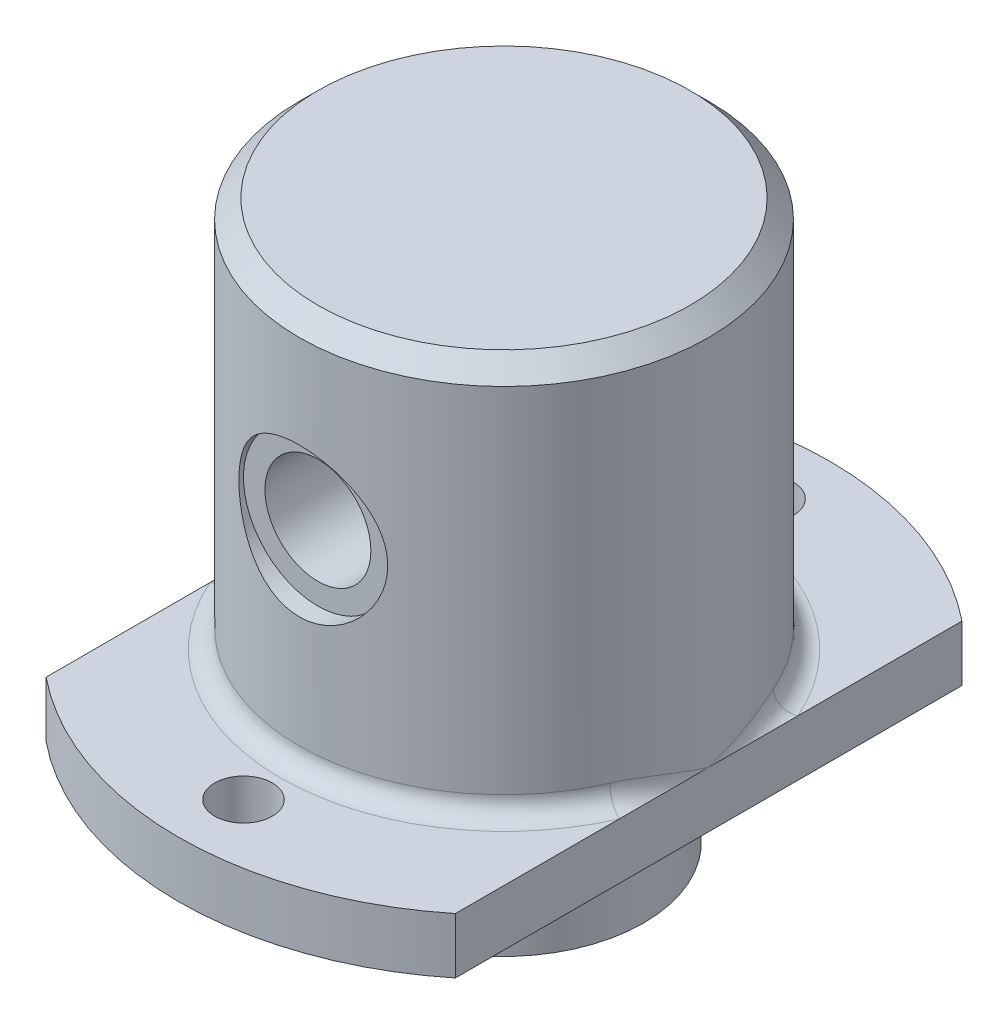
SolidWorks part; units mm, degrees
ref_plane "Front Plane" through (0, 0, 0) normal (0, 0, 1) x (1, 0, 0)
ref_plane "Top Plane" through (0, 0, 0) normal (0, 1, 0) x (1, 0, 0)
ref_plane "Right Plane" through (0, 0, 0) normal (1, 0, 0) x (0, 0, -1)
sketch "Sketch1" plane through (0, 0, 0) normal (0, 0, 1) x (1, 0, 0)
  line L0 (0, 0) -> (0, -21156.862) construction
  line L1 (0, 0) -> (21156.862, 0) construction
  line L2 (0, 30) -> (-11, 30)
  line L3 (-11, 30) -> (-11, 9)
  line L4 (-11, 9) -> (-17.5, 9)
  line L5 (-17.5, 9) -> (-17.5, 6)
  line L6 (-17.5, 6) -> (-11, 6)
  line L7 (-11, 6) -> (-11, 0)
  line L8 (-11, 0) -> (-6, 0)
  line L10 (0, 30) -> (0, 25)
  line L11 (-6, 0) -> (-6, 25)
  line L12 (-6, 25) -> (0, 25)
  point P13 (-5.7833, 0.306)
  dimension "D1" = 21
  dimension "D2" = 3
  dimension "D3" = 35
  dimension "D4" = 12
  dimension "D5" = 6
  dimension "D6" = 22
  dimension "D7" = 22
  dimension "D8" = 25
revolve "Revolve1" add sketch "Sketch1" angle 360 about L0
sketch "Sketch2" plane through (0, 9, 0) normal (0, 1, 0) x (1, 0, 0)
  line L0 (11, -13.6107) -> (11, 13.6107)
  line L1 (-11, -13.6107) -> (-11, 13.6107)
  arc A0 (-11, 13.6107) -> (11, 13.6107) centre (0, 0) ccw
  circle A2 centre (0, 0) radius 17.5 construction
  point P3 (11, 0)
  point P6 (-11, 0)
  dimension "D1" = 27.2213
  dimension "D2" = 11
  dimension "D3" = 27.2213
  dimension "D4" = 11
extrude "Cut-Extrude2" cut sketch "Sketch2" against normal blind 10 contours L1 M1 | L0 M1
sketch "Sketch3" plane through (0, 0, 0) normal (0, -1, 0) x (1, 0, 0)
  circle A0 centre (0, 0) radius 7.5
  dimension "D1" = 15
extrude "Cut-Extrude3" cut sketch "Sketch3" against normal blind 6 contours A0 M3
ref_plane "Plane2" through (0, 0, 11) normal (0, 0, 1) x (1, 0, 0)
sketch "Sketch4" plane through (0, 0, 11) normal (0, 0, 1) x (1, 0, 0)
  circle A0 centre (0, 20) radius 4
  dimension "D2" = 8
  dimension "D1" = 20
extrude "Cut-Extrude4" cut sketch "Sketch4" against normal blind 1
sketch "Sketch5" plane through (0, 0, 10) normal (0, 0, 1) x (1, 0, 0)
  circle A0 centre (0, 20) radius 2.8462
  dimension "D1" = 20
extrude "Cut-Extrude5" cut sketch "Sketch5" against normal blind 8
fillet "Fillet1" radius 1 2 edges at (0, 9, -11) (0, 9, 11)
chamfer "Chamfer1" distance 1 angle 45 1 edges at (0, 30, 11)
sketch "Sketch6" plane through (0, 9, 0) normal (0, 1, 0) x (1, 0, 0)
  circle A0 centre (0, -14) radius 1.55
  dimension "D2" = 3.1
  dimension "D1" = 14
extrude "Cut-Extrude6" cut sketch "Sketch6" against normal through all
sketch "Sketch7" plane through (0, 9, 0) normal (0, 1, 0) x (1, 0, 0)
  circle A0 centre (0, 14) radius 1.55
  dimension "D1" = 3.1
  dimension "D2" = 14
extrude "Cut-Extrude7" cut sketch "Sketch7" against normal through all
